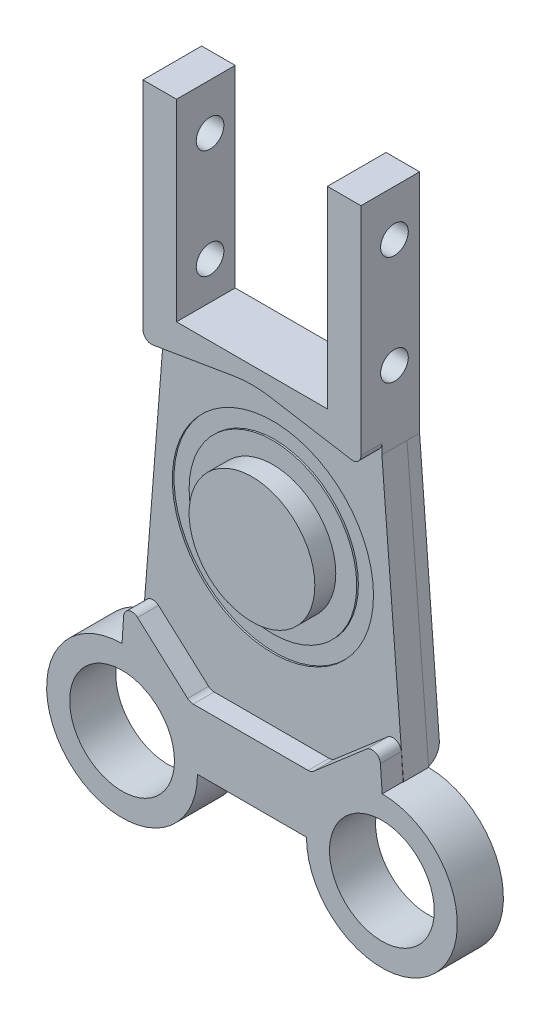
SolidWorks part; units mm, degrees
ref_plane "前视基准面" through (0, 0, 0) normal (0, 0, 1) x (1, 0, 0)
ref_plane "上视基准面" through (0, 0, 0) normal (0, 1, 0) x (1, 0, 0)
ref_plane "右视基准面" through (0, 0, 0) normal (1, 0, 0) x (0, 0, -1)
other "Configuration Table"
sketch "草图1" plane through (0, 0, 0) normal (0, 0, 1) x (1, 0, 0)
  line L0 (0, 0) -> (41.7451, 0) construction
  line L1 (0, 0) -> (0, 25.5129) construction
  line L2 (-13, 24) -> (-13, 0)
  line L3 (-13, 0) -> (13, 0)
  line L4 (13, 0) -> (13, 24)
  line L5 (13, 24) -> (9, 24)
  line L6 (9, 24) -> (9, 4)
  line L7 (9, 4) -> (-9, 4)
  line L8 (-9, 4) -> (-9, 24)
  line L9 (-9, 24) -> (-13, 24)
  dimension "D1" = 24
  dimension "D2" = 24
  dimension "D3" = 20
  dimension "D4" = 4
  dimension "D5" = 4
  dimension "D6" = 26
  dimension "D7" = 9
extrude "凸台-拉伸1" add sketch "草图1" along normal blind 1.5
sketch "草图4" plane through (0, 0, 1.5) normal (0, 0, 1) x (1, 0, 0)
  line L8 (-9, 24) -> (-13, 24)
  line L9 (-13, 24) -> (-13, 0)
  line L10 (-13, 0) -> (13, 0)
  line L11 (13, 0) -> (13, 24)
  line L12 (13, 24) -> (9, 24)
  line L13 (9, 24) -> (9, 4)
  line L14 (9, 4) -> (-9, 4)
  line L15 (-9, 4) -> (-9, 24)
  line L16 (-9, 24) -> (-13, 24)
  line L17 (-13, 24) -> (-13, 0)
  line L18 (-13, 0) -> (13, 0)
  line L19 (13, 0) -> (13, 24)
  line L20 (13, 24) -> (9, 24)
  line L21 (9, 24) -> (9, 4)
  line L22 (9, 4) -> (-9, 4)
  line L23 (-9, 4) -> (-9, 24)
  dimension "D1" = 0
extrude "凸台-拉伸3" add sketch "草图4" along normal blind 5.5
sketch "草图10" plane through (0, 0, 7) normal (0, 0, 1) x (1, 0, 0)
  line L0 (0, 0) -> (42.57, 0) construction
  line L1 (0, 0) -> (0, 29.1087) construction
  line L2 (-13, 0) -> (-15.5794, -32.5004)
  line L3 (-6.5, -41.5) -> (6.5, -41.5)
  line L4 (15.5794, -32.5004) -> (13, 0)
  line L5 (13, 0) -> (-13, 0)
  arc A0 (-15.5794, -32.5004) -> (-6.5, -41.5) centre (-15.5, -41.5) ccw
  arc A1 (6.5, -41.5) -> (15.5794, -32.5004) centre (15.5, -41.5) ccw
  dimension "D1" = 18
  dimension "D2" = 18
  dimension "D3" = 41.5
  dimension "D4" = 41.5
  dimension "D5" = 15.5
  dimension "D6" = 15.5
  dimension "D7" = 41.5
extrude "凸台-拉伸6" add sketch "草图10" against normal blind 5.5
sketch "草图11" plane through (0, 0, 7) normal (0, 0, 1) x (1, 0, 0)
  circle A0 centre (-15.5, -41.5) radius 6.25
  circle A1 centre (15.5, -41.5) radius 6.25
  dimension "D1" = 12.5
  dimension "D2" = 12.5
extrude "切除-拉伸2" cut sketch "草图11" against normal blind 5.5
sketch "草图12" plane through (0, 0, 7) normal (0, 0, 1) x (1, 0, 0)
  line L0 (9, 4) -> (-9, 4) construction
  line L2 (-13, 0) -> (-2.1517, 1.8207)
  line L3 (-6.5, -41.5) -> (6.5, -41.5)
  line L4 (13, 0) -> (2.1517, 1.8207)
  line L6 (-15.5794, -32.5004) -> (-13, 0)
  line L7 (15.5794, -32.5004) -> (13, 0)
  arc A0 (2.1517, 1.8207) -> (-2.1517, 1.8207) centre (0, -11) ccw
  arc A1 (-6.5, -41.5) -> (-15.5794, -32.5004) centre (-15.5, -41.5) ccw
  arc A2 (15.5794, -32.5004) -> (6.5, -41.5) centre (15.5, -41.5) ccw
  dimension "D1" = 26
  dimension "D2" = 15
extrude "切除-拉伸3" cut sketch "草图12" against normal blind 5
sketch "草图13" plane through (0, 0, 1.5) normal (0, 0, -1) x (-1, 0, 0)
  line L0 (-6.5, -41.5) -> (6.5, -41.5)
  line L1 (-15.5, -32.5) -> (-13, 0)
  line L2 (-15.5794, -32.5004) -> (-13, 0) construction
  line L3 (-13, 0) -> (13, 0)
  line L4 (13, 0) -> (15.5794, -32.5004) construction
  line L5 (13, 0) -> (15.5794, -32.5004)
  arc A0 (-6.5, -41.5) -> (-15.5, -32.5) centre (-15.5, -41.5) ccw
  arc A1 (15.5794, -32.5004) -> (6.5, -41.5) centre (15.5, -41.5) ccw
extrude "凸台-拉伸7" add sketch "草图13" along normal blind 1.5
fillet "圆角3" radius 2 2 edges at (9.136, -35.136, 0) (-9.1642, -35.108, 0)
sketch "草图14" plane through (0, 0, 2) normal (0, 0, 1) x (1, 0, 0)
  line L0 (-15.5, -32.5) -> (15.5, -32.5)
  line L1 (-6.5, -41.5) -> (6.5, -41.5)
  line L2 (-6.5, -41.5) -> (6.5, -41.5) construction
  circle A0 centre (-15.5, -41.5) radius 9 construction
  arc A1 (-6.5, -41.5) -> (-15.5794, -32.5004) centre (-15.5, -41.5) ccw construction
  circle A2 centre (15.5, -41.5) radius 9 construction
  arc A3 (15.5794, -32.5004) -> (6.5, -41.5) centre (15.5, -41.5) ccw construction
  arc A4 (-6.5, -41.5) -> (-15.5, -32.5) centre (-15.5, -41.5) ccw
  arc A5 (15.5, -32.5) -> (6.5, -41.5) centre (15.5, -41.5) ccw
extrude "凸台-拉伸8" add sketch "草图14" along normal blind 5
sketch "草图16" plane through (0, 0, 7) normal (0, 0, 1) x (1, 0, 0)
  circle A0 centre (0, -22) radius 17
  dimension "D2" = 34
  dimension "D1" = 22
extrude "切除-拉伸4" cut sketch "草图16" against normal blind 5
sketch "草图17" plane through (0, 0, 7) normal (0, 0, 1) x (1, 0, 0)
  line L0 (-15.5, -32.5) -> (-15.1825, -27.5)
  line L1 (-13, 0) -> (-15.5794, -32.5004) construction
  line L2 (-15.1825, -27.5) -> (-7.3924, -34.5)
  line L3 (15.5397, -32.5001) -> (15.1825, -27.5001)
  line L5 (15.5794, -32.5004) -> (13, 0) construction
  line L6 (15.5397, -32.5001) -> (13.3697, -32.5)
  line L7 (-15.5, -32.5) -> (-13.3697, -32.5)
  line L8 (15.1825, -27.5001) -> (7.075, -34.5)
  line L9 (-7.3924, -34.5) -> (7.075, -34.5)
  arc A1 (15.5794, -32.5004) -> (15.5, -32.5) centre (15.5, -41.5) ccw construction
  arc A2 (-13.3697, -32.5) -> (13.3697, -32.5) centre (0, -22) ccw
  dimension "D1" = 5
  dimension "D2" = 5
extrude "凸台-拉伸9" add sketch "草图17" against normal blind 5
fillet "圆角6" radius 1 4 edges at (7.075, -34.5, 4.5) (-7.3924, -34.5, 4.5) (15.1825, -27.5001, 4.5) (-15.1825, -27.5, 4.5)
sketch "草图18" plane through (0, 0, 2) normal (0, 0, 1) x (1, 0, 0)
  circle A0 centre (0, -15) radius 7.5
  dimension "D1" = 15
  dimension "D2" = 15
extrude "凸台-拉伸10" add sketch "草图18" along normal blind 5
fillet "圆角7" radius 1 2 edges at (13, 0, 4.5) (-13, 0, 4.5)
fillet "圆角8" radius 1 3 edges at (5.7883, -41.5, 0.4189) (-5.7883, -41.5, 0.4189) (0, -41.5, 0)
hole_wizard "M4 螺纹孔1" positions "草图21" profile "草图22" tap size "M4" standard "GB"
sketch "草图21" plane through (-13, 0, 0) normal (-1, 0, 0) x (0, 0, 1)
  line L0 (0, 24) -> (0, 0) construction
  line L1 (7, 24) -> (0, 24) construction
  point P0 (3, 21.5)
  point P2 (3, 8.5)
  dimension "D1" = 3
  dimension "D2" = 3
  dimension "D3" = 2.5
  dimension "D4" = 13
sketch "草图22" plane through (-13, 21.5, 3) normal (0, 1, 0) x (0, 0, 1)
  line L0 (0, 0) -> (0, 37.5)
  line L1 (0, 37.5) -> (1.65, 37.5)
  line L2 (1.65, 37.5) -> (1.65, 0)
  line L5 (1.65, 0) -> (0, 0)
  line L11 (0, -6.35) -> (0, 107.95) construction
  dimension "通孔螺纹孔钻头直径" = 3.3
  dimension "通孔螺纹孔钻头深度" = 37.5
sketch "草图23" plane through (0, 24, 0) normal (0, 1, 0) x (1, 0, 0)
  line L1 (-13, 0) -> (-9, 0)
  line L2 (-13, 0) -> (-13, -7)
  line L3 (-13, -7) -> (-9, -7)
  line L4 (-9, 0) -> (-9, -7)
  line L5 (9, 0) -> (13, 0)
  line L6 (9, 0) -> (9, -7)
  line L7 (9, -7) -> (13, -7)
  line L8 (13, 0) -> (13, -7)
extrude "凸台-拉伸11" add sketch "草图23" along normal blind 3
sketch "草图24" plane through (0, 0, 2) normal (0, 0, 1) x (1, 0, 0)
  line L13 (-15.5, -32.5) -> (-15.3134, -29.5603)
  line L14 (-13.647, -28.8798) -> (-7.6775, -34.2438)
  line L15 (-7.0091, -34.5) -> (6.703, -34.5)
  line L16 (7.3566, -34.2569) -> (13.6736, -28.8029)
  line L17 (15.3246, -29.4885) -> (15.5397, -32.5001)
  line L18 (15.5794, -32.5004) -> (15.1825, -27.5001)
  line L19 (15.1825, -27.5001) -> (13, 0)
  line L20 (13, 0) -> (13, 1.1818)
  line L21 (11.8345, 0.1956) -> (2.1517, 1.8207)
  line L22 (-2.1517, 1.8207) -> (-11.8345, 0.1956)
  line L23 (-13, 1.1818) -> (-13, 0)
  line L24 (-13, 0) -> (-15.1825, -27.5)
  line L25 (-15.1825, -27.5) -> (-15.5794, -32.5004)
  line L26 (-15.5, -32.5) -> (-15.3134, -29.5603)
  line L27 (-13.647, -28.8798) -> (-7.6775, -34.2438)
  line L28 (-7.0091, -34.5) -> (6.703, -34.5)
  line L29 (7.3566, -34.2569) -> (13.6736, -28.8029)
  line L30 (15.3246, -29.4885) -> (15.5397, -32.5001)
  line L31 (15.5794, -32.5004) -> (15.1825, -27.5001)
  line L32 (15.1825, -27.5001) -> (13, 0)
  line L33 (13, 0) -> (13, 1.1818)
  line L34 (11.8345, 0.1956) -> (2.1517, 1.8207)
  line L35 (-2.1517, 1.8207) -> (-11.8345, 0.1956)
  line L36 (-13, 1.1818) -> (-13, 0)
  line L37 (-13, 0) -> (-15.1825, -27.5)
  line L38 (-15.1825, -27.5) -> (-15.5794, -32.5004)
  arc A9 (-13.647, -28.8798) -> (-15.3134, -29.5603) centre (-14.3154, -29.6236) ccw
  arc A10 (-7.6775, -34.2438) -> (-7.0091, -34.5) centre (-7.0091, -33.5) ccw
  arc A11 (6.703, -34.5) -> (7.3566, -34.2569) centre (6.703, -33.5) ccw
  arc A12 (15.3246, -29.4885) -> (13.6736, -28.8029) centre (14.3271, -29.5598) ccw
  arc A13 (15.5794, -32.5004) -> (15.5397, -32.5001) centre (15.5, -41.5) ccw
  arc A14 (11.8345, 0.1956) -> (13, 1.1818) centre (12, 1.1818) ccw
  arc A15 (2.1517, 1.8207) -> (-2.1517, 1.8207) centre (0, -11) ccw
  arc A16 (-13, 1.1818) -> (-11.8345, 0.1956) centre (-12, 1.1818) ccw
  arc A17 (-15.5, -32.5) -> (-15.5794, -32.5004) centre (-15.5, -41.5) ccw
  arc A18 (-13.647, -28.8798) -> (-15.3134, -29.5603) centre (-14.3154, -29.6236) ccw
  arc A19 (-7.6775, -34.2438) -> (-7.0091, -34.5) centre (-7.0091, -33.5) ccw
  arc A20 (6.703, -34.5) -> (7.3566, -34.2569) centre (6.703, -33.5) ccw
  arc A21 (15.3246, -29.4885) -> (13.6736, -28.8029) centre (14.3271, -29.5598) ccw
  arc A22 (15.5794, -32.5004) -> (15.5397, -32.5001) centre (15.5, -41.5) ccw
  arc A23 (11.8345, 0.1956) -> (13, 1.1818) centre (12, 1.1818) ccw
  arc A24 (2.1517, 1.8207) -> (-2.1517, 1.8207) centre (0, -11) ccw
  arc A25 (-13, 1.1818) -> (-11.8345, 0.1956) centre (-12, 1.1818) ccw
  arc A26 (-15.5, -32.5) -> (-15.5794, -32.5004) centre (-15.5, -41.5) ccw
  dimension "D1" = 0
extrude "凸台-拉伸12" add sketch "草图24" along normal blind 2.5
sketch "草图25" plane through (0, 0, 4.5) normal (0, 0, 1) x (1, 0, 0)
  circle A0 centre (0, -15) radius 10
  circle A1 centre (0, -15) radius 12
  dimension "D1" = 20
  dimension "D2" = 24
extrude "切除-拉伸5" cut sketch "草图25" against normal blind 0.2
